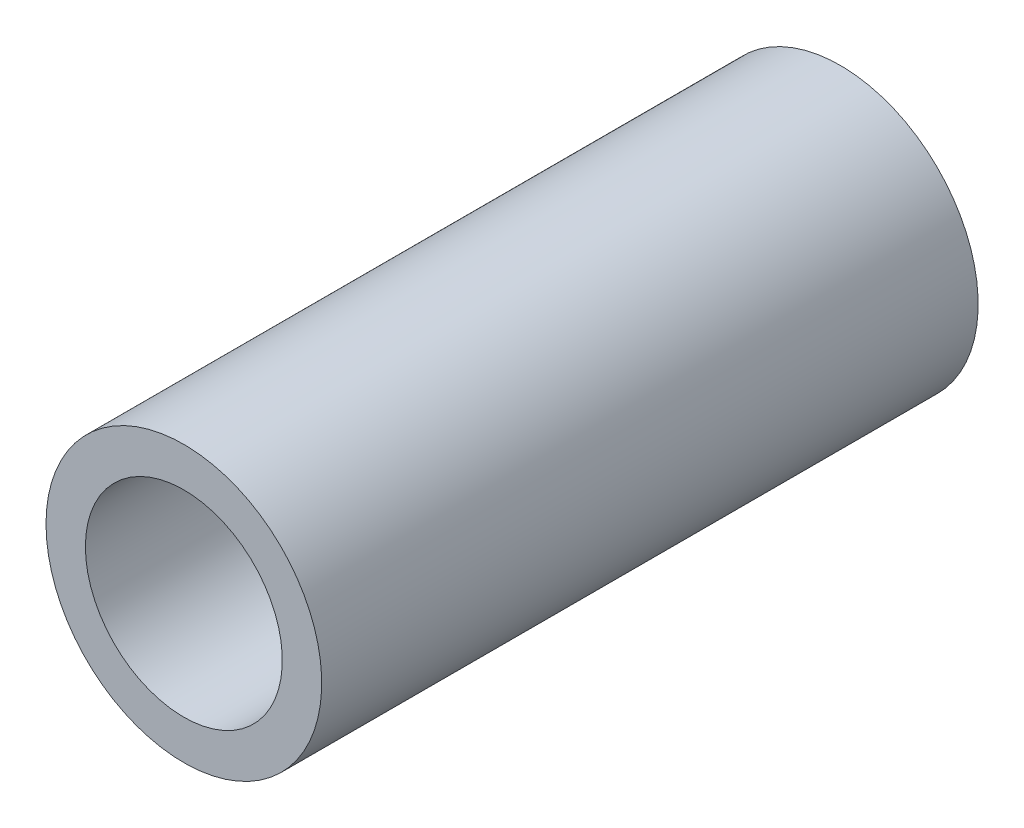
SolidWorks part; units mm, degrees
ref_plane "Plan de face" through (0, 0, 0) normal (0, 0, 1) x (1, 0, 0)
ref_plane "Plan de dessus" through (0, 0, 0) normal (0, 1, 0) x (1, 0, 0)
ref_plane "Plan de droite" through (0, 0, 0) normal (1, 0, 0) x (0, 0, -1)
sketch "Esquisse1" plane through (0, 0, 0) normal (0, 0, 1) x (1, 0, 0)
  circle A0 centre (0, 0) radius 21
  dimension "D1" = 42
extrude "Extru.-Mince1" add sketch "Esquisse1" along normal blind 100 thin
